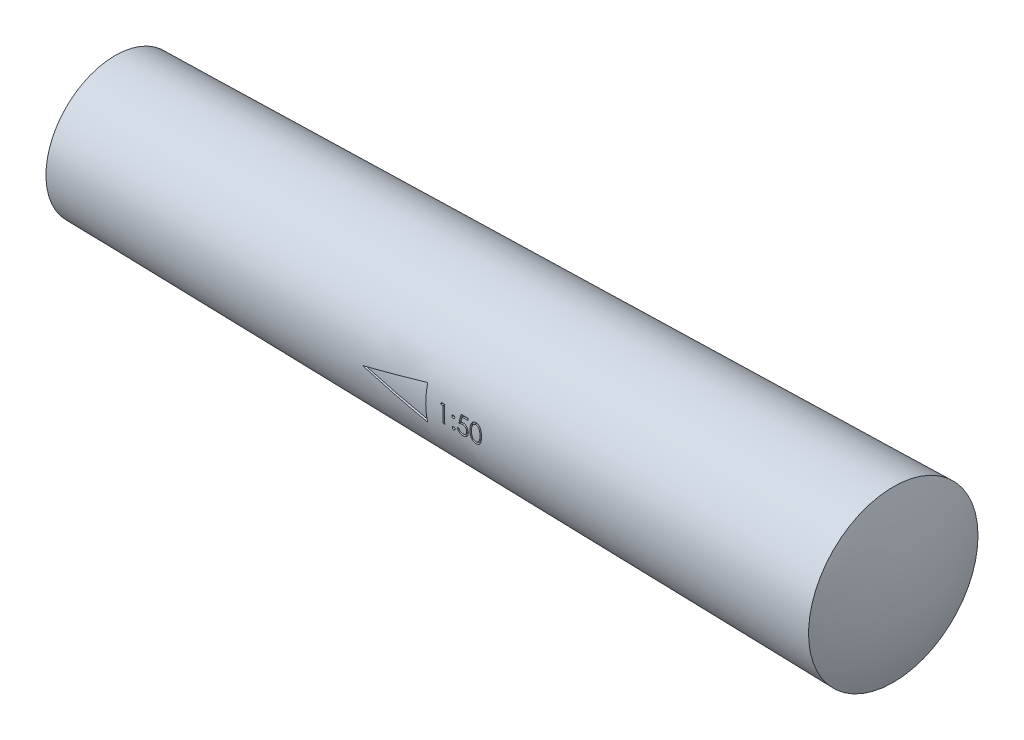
SolidWorks part; units mm, degrees
ref_plane "Front Plane" through (0, 0, 0) normal (0, 0, 1) x (1, 0, 0)
ref_plane "Top Plane" through (0, 0, 0) normal (0, 1, 0) x (1, 0, 0)
ref_plane "Right Plane" through (0, 0, 0) normal (1, 0, 0) x (0, 0, -1)
sketch "Sketch1" plane through (0, 0, 0) normal (1, 0, 0) x (0, 0, -1)
  circle A0 centre (0, 0) radius 4
  dimension "D1" = 8
extrude "Extrude1" add sketch "Sketch1" along normal mid plane 45
draft "Draft1" type of draft neutral plane draft angle 1.146 faces to draft 1 parameters "D1"=1.146
sketch "Sketch2" plane through (0, 0, 0) normal (0, 0, 1) x (1, 0, 0)
  line L0 (-22.5, 0) -> (-22.5, 4)
  line L1 (-22.5, 4) -> (-22.5, -4) construction
  line L2 (-22.5, 0) -> (-23.5, 0)
  line L3 (-23.5, 0) -> (-23.5, -4.45) construction
  line L4 (22.5, 0) -> (22.5, 4.9)
  line L5 (22.5, -4.9) -> (22.5, 4.9) construction
  line L6 (22.5, 0) -> (23.5, 0)
  line L7 (23.5, 0) -> (23.5, -4.45) construction
  line L8 (-22.5, -4) -> (22.5, -4.9) construction
  arc A0 (-23.5, 0) -> (-22.5, 4) centre (-15, 0) cw
  arc A1 (23.5, 0) -> (22.5, 4.9) centre (10.9949, 0) ccw
  point P14 (0, -4.45)
revolve "Revolve1" add sketch "Sketch2" angle 360 about L2
sketch "Sketch5" plane through (0, 0, 0) normal (0, 0, 1) x (1, 0, 0)
  line L0 (0, 4.45) -> (0, -4.45) construction
  line L1 (22.5, 4.9) -> (-22.5, 4) construction
  line L2 (-22.5, -4) -> (22.5, -4.9) construction
ref_plane "Plane2" through (0, 0, 0) normal (-0.02, 0, 0.9998) x (0.9998, 0, 0.02)
sketch "Sketch6" plane through (0, 0, 0) normal (-0.02, 0, 0.9998) x (0.9998, 0, 0.02)
  line L0 (0, 0) -> (0, 1)
  line L1 (0, 4.45) -> (0, -4.45) construction
  line L2 (0, 1) -> (-3.7321, 0)
  line L3 (-3.7321, 0) -> (0, -1)
  line L4 (0, -1) -> (0, 0)
  line L5 (0, -0.5) -> (4, -0.5) construction
  text T0 "1:50" font "Century Gothic" height 1
  dimension "D1" = 2
  dimension "D2" = 30
  dimension "D3" = 4
wrap "Wrap2" sketch "Sketch6" wrap type deboss source sketch "Sketch6" thickness 0.1 parameters "D1"=0.1
equation "\"D2@Sketch2\" = \"D1@Sketch2\""
